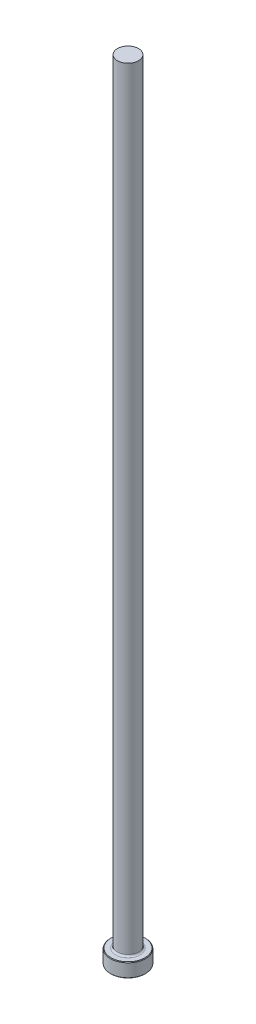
SolidWorks part; units mm, degrees
ref_plane "Front Plane" through (0, 0, 0) normal (0, 0, 1) x (1, 0, 0)
ref_plane "Top Plane" through (0, 0, 0) normal (0, 1, 0) x (1, 0, 0)
ref_plane "Right Plane" through (0, 0, 0) normal (1, 0, 0) x (0, 0, -1)
sketch "Sketch1" plane through (0, 0, 0) normal (0, 0, 1) x (1, 0, 0)
  line L0 (0, 259.9588) -> (0, -15.1925) construction
  line L1 (0, 0) -> (-7.9375, 0)
  line L2 (-7.9375, 0) -> (-7.9375, 6.35)
  line L3 (-7.9375, 6.35) -> (-4.7625, 6.35)
  line L4 (-4.7625, 6.35) -> (-4.7625, 355.6)
  line L5 (-4.7625, 355.6) -> (0, 355.6)
  line L6 (0, 355.6) -> (0, 0)
  dimension "L" = 355.6
  dimension "H" = 15.875
  dimension "T" = 6.35
  dimension "D" = 9.525
revolve "Revolve1" add sketch "Sketch1" angle 360 about L0
chamfer "Chamfer1" distance 0.254 angle 45 2 edges at (0, 6.35, 7.9375) (0, 0, 7.9375)
fillet "Fillet1" radius 0.762 1 edges at (0, 6.35, 4.7625)
sketch "Pocket Sketch" plane through (0, 0, 0) normal (0, 0, 1) x (1, 0, 0)
  line L0 (-8.3344, 0) -> (-8.3344, 6.3754)
  line L1 (-8.3344, 6.3754) -> (-5.9214, 6.3754)
  line L2 (-5.1594, 7.1374) -> (-5.1594, 22.225)
  line L3 (-5.1594, 22.225) -> (0, 22.225)
  line L4 (0, 22.225) -> (0, 0)
  line L5 (0, 0) -> (-8.3344, 0)
  line L6 (0, 12.6104) -> (0, -2.4989) construction
  line L7 (-7.9375, 6.096) -> (-7.9375, 0.254) construction
  line L8 (7.6835, 6.35) -> (-7.6835, 6.35) construction
  line L9 (-4.7625, 355.6) -> (-4.7625, 7.112) construction
  line L10 (-5.9214, 6.3754) -> (-5.1594, 7.1374)
  point P3 (-5.1594, 6.3754)
  dimension "D1" = 16.6687
  dimension "D2" = 0.3969
  dimension "D3" = 0.0254
  dimension "D4" = 0.3969
  dimension "D5" = 10.3187
  dimension "D6" = 22.225
